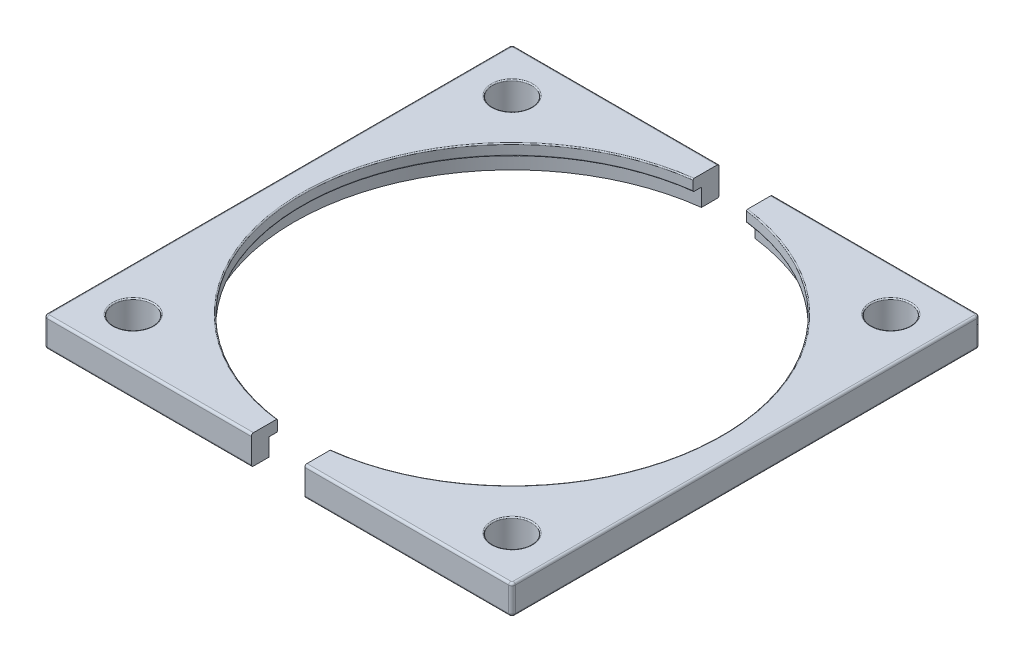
SolidWorks part; units mm, degrees
ref_plane "Front Plane" through (0, 0, 0) normal (0, 0, 1) x (1, 0, 0)
ref_plane "Top Plane" through (0, 0, 0) normal (0, 1, 0) x (1, 0, 0)
ref_plane "Right Plane" through (0, 0, 0) normal (1, 0, 0) x (0, 0, -1)
sketch "Sketch1" plane through (0, 0, 0) normal (0, 1, 0) x (1, 0, 0)
  line L0 (-105, 0) -> (105, 0) construction
  line L1 (0, 105) -> (0, -105) construction
  line L2 (-12, 105) -> (-12, 93.2309)
  line L3 (-103.5, 105) -> (-12, 105)
  line L4 (-105, 103.5) -> (-105, -103.5)
  line L5 (-103.5, -105) -> (-12, -105)
  line L6 (105, 103.5) -> (105, -103.5)
  line L7 (12, 105) -> (12, 93.2309)
  line L8 (12, -105) -> (103.5, -105)
  line L9 (-12, -93.2309) -> (-12, -105)
  line L10 (12, -93.2309) -> (12, -105)
  line L11 (12, 105) -> (103.5, 105)
  arc A0 (12, -93.2309) -> (12, 93.2309) centre (0, 0) ccw
  circle A1 centre (-85, 85) radius 8.75
  arc A2 (-105, -103.5) -> (-103.5, -105) centre (-103.5, -103.5) ccw
  arc A3 (103.5, -105) -> (105, -103.5) centre (103.5, -103.5) ccw
  arc A4 (103.5, 105) -> (105, 103.5) centre (103.5, 103.5) cw
  arc A5 (-103.5, 105) -> (-105, 103.5) centre (-103.5, 103.5) ccw
  circle A6 centre (85, 85) radius 8.75
  circle A7 centre (85, -85) radius 8.75
  circle A8 centre (-85, -85) radius 8.75
  arc A9 (-12, 93.2309) -> (-12, -93.2309) centre (0, 0) ccw
  point P15 (-105, -105)
  point P20 (105, 105)
  point P23 (-105, 105)
  dimension "D1" = 188
  dimension "D6" = 17.5
  dimension "D9" = 1.5
  dimension "D2" = 210
  dimension "D3" = 210
  dimension "D4" = 105
  dimension "D5" = 105
  dimension "D7" = 170
  dimension "D8" = 170
  dimension "D10" = 24
  dimension "D11" = 12
extrude "Boss-Extrude1" add sketch "Sketch1" along normal blind 13
sketch "Sketch2" plane through (0, 0, 0) normal (0, -1, 0) x (1, 0, 0)
  circle A0 centre (0, 0) radius 97.75
  dimension "D1" = 195.5
extrude "Cut-Extrude1" cut sketch "Sketch2" against normal blind 7.9
fillet "Fillet1" radius 0.5 4 edges at (-94, 7.9, 0) (-94, 13, 0) (-85, 13, 76.25) (-85, 13, -76.25)
fillet "Fillet2" radius 0.5 4 edges at (94, 7.9, 0) (94, 13, 0) (85, 13, 93.75) (85, 13, -93.75)
fillet "Fillet3" radius 1 10 edges at (-57.75, 13, -105) (-104.5607, 13, -104.5607) (-57.75, 13, 105) (-104.5607, 13, 104.5607) (-57.75, 0, -105) (-104.5607, 0, -104.5607) (-57.75, 0, 105) (-104.5607, 0, 104.5607) (-105, 13, 0) (-105, 0, 0)
fillet "Fillet4" radius 1 10 edges at (57.75, 13, 105) (104.5607, 13, 104.5607) (57.75, 13, -105) (104.5607, 13, -104.5607) (57.75, 0, 105) (104.5607, 0, 104.5607) (57.75, 0, -105) (104.5607, 0, -104.5607) (105, 13, 0) (105, 0, 0)
